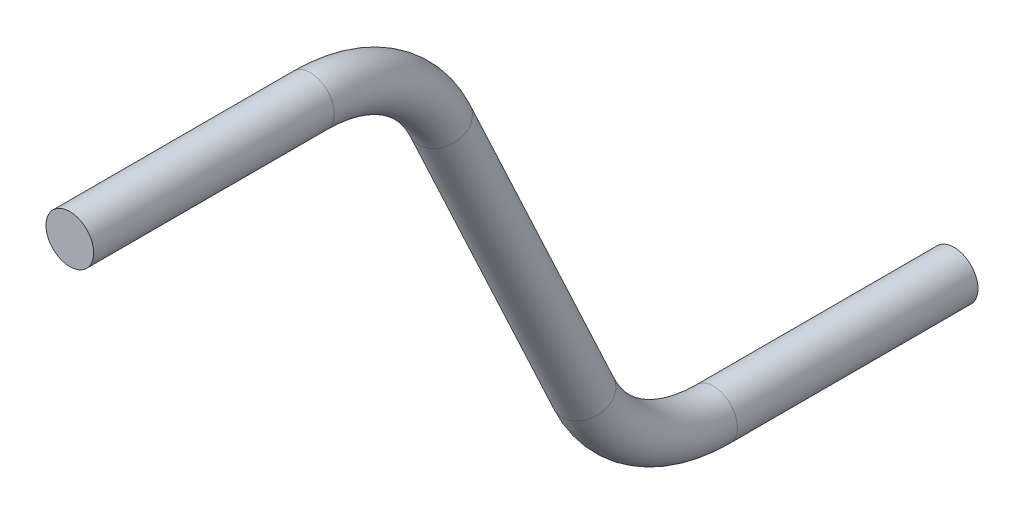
SolidWorks part; units mm, degrees
ref_plane "Front Plane" through (0, 0, 0) normal (0, 0, 1) x (1, 0, 0)
ref_plane "Top Plane" through (0, 0, 0) normal (0, 1, 0) x (1, 0, 0)
ref_plane "Right Plane" through (0, 0, 0) normal (1, 0, 0) x (0, 0, -1)
sketch "Sketch1" plane through (0, 0, 0) normal (0, 0, 1) x (1, 0, 0)
  circle A0 centre (0, 0) radius 1.5875
  dimension "D1" = 3.175
extrude "Extrude1" add sketch "Sketch1" along normal blind 16.002
sketch "Sketch2" plane through (0, 0, 16.002) normal (0, 0, 1) x (1, 0, 0)
  circle A0 centre (0, 0) radius 1.5875
  dimension "D1" = 3.175
sketch "sweep_sketch" plane through (0, 0, 0) normal (1, 0, 0) x (0, 0, -1)
  line L0 (-16.002, 0) -> (-16.002, 9.525) construction
  line L1 (-16.002, 1.5875) -> (-16.002, -1.5875) construction
  line L2 (-24.6346, 5.4996) -> (-16.002, 9.525) construction
  line L3 (-24.6346, 5.4996) -> (-34.1792, 25.968)
  line L4 (-34.1792, 25.968) -> (-42.8118, 21.9426) construction
  line L5 (-42.8118, 21.9426) -> (-42.8118, 31.4676) construction
  line L6 (-42.8118, 31.4676) -> (-58.8138, 31.4676)
  arc A0 (-16.002, 0) -> (-24.6346, 5.4996) centre (-16.002, 9.525) cw
  arc A1 (-34.1792, 25.968) -> (-42.8118, 31.4676) centre (-42.8118, 21.9426) ccw
  dimension "D2" = 65
  dimension "D7" = 31.4676
  dimension "D1" = 9.525
  dimension "D3" = 9.525
  dimension "D4" = 65
  dimension "D5" = 16.002
  dimension "D6" = 22.5845
sweep "Sweep1" add profiles "Sketch2" path "sweep_sketch"
equation "\"D4@sweep_sketch\" = \"D2@sweep_sketch\""
equation "\"D6@sweep_sketch\" =3 - 2*pi*(\"D1@sweep_sketch\")*(2*\"D2@sweep_sketch\")/360 - 2*\"D5@sweep_sketch\""
equation "\"D5@sweep_sketch\" = \"D1@Extrude1\""
